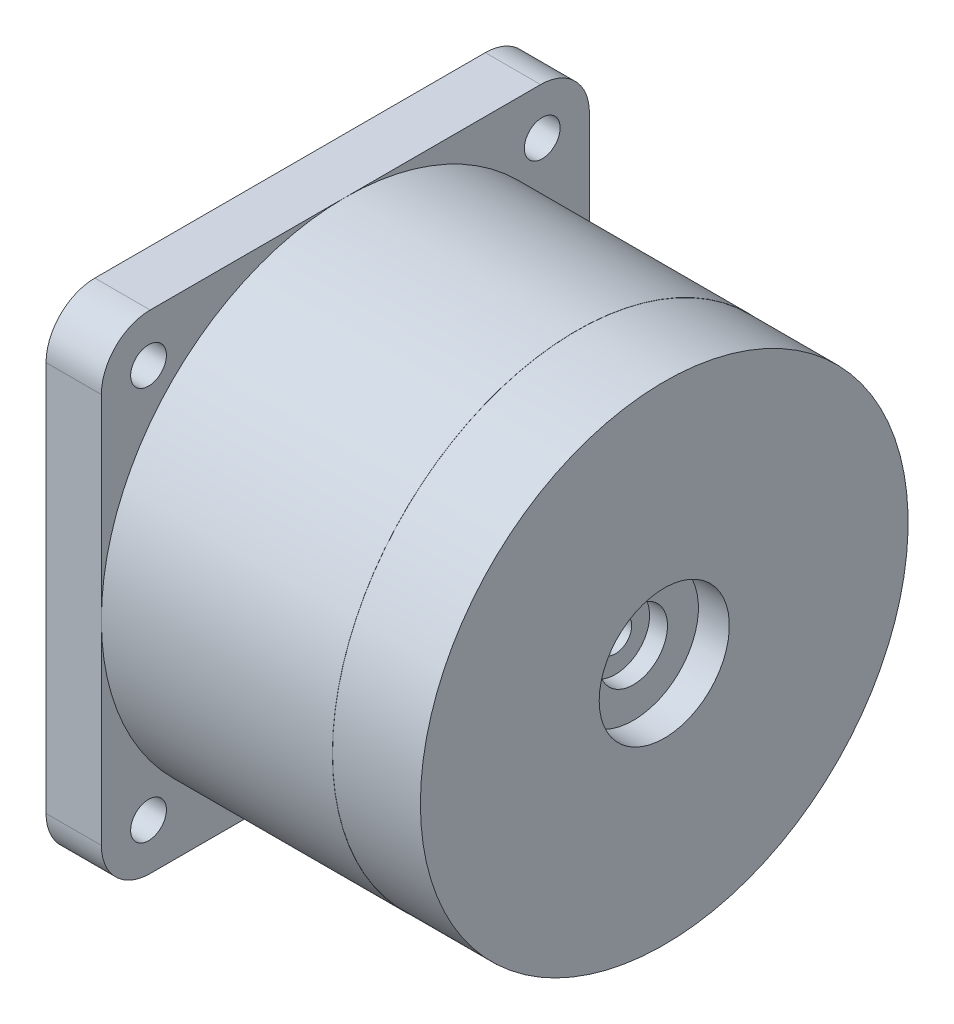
SolidWorks part; units mm, degrees
ref_plane "Plan de face" through (0, 0, 0) normal (0, 0, 1) x (1, 0, 0)
ref_plane "Plan de dessus" through (0, 0, 0) normal (0, 1, 0) x (1, 0, 0)
ref_plane "Plan de droite" through (0, 0, 0) normal (1, 0, 0) x (0, 0, -1)
sketch "Esquisse1" plane through (0, 0, 0) normal (0, 0, 1) x (1, 0, 0)
  line L0 (0, 0) -> (49.68, 0) construction
  line L1 (0, 0) -> (0, 14.99)
  line L2 (0, 14.99) -> (-5.4, 14.99)
  line L3 (-5.4, 14.99) -> (-5.4, 15)
  line L4 (-5.4, 15) -> (-19.6, 15)
  line L5 (-19.6, 15) -> (-19.6, 0)
  line L6 (-19.6, 0) -> (0, 0)
  dimension "D1" = 30
  dimension "D2" = 29.98
  dimension "D3" = 5.4
  dimension "D4" = 19.6
revolve "Révolution1" add sketch "Esquisse1" angle 360 about L0
sketch "Esquisse2" plane through (-19.6, 0, 0) normal (-1, 0, 0) x (0, 0, 1)
  line L0 (-12.1, 12.1) -> (12.1, 12.1) construction
  line L1 (-15, 15) -> (15, 15)
  line L2 (-15, 15) -> (-15, -15)
  line L3 (-15, -15) -> (15, -15)
  line L4 (15, 15) -> (15, -15)
  line L5 (12.1, 12.1) -> (12.1, -12.1) construction
  line L6 (-12.1, -12.1) -> (12.1, -12.1) construction
  line L7 (-12.1, 12.1) -> (-12.1, -12.1) construction
  circle A0 centre (-12.1, 12.1) radius 1.1
  circle A1 centre (12.1, 12.1) radius 1.1
  circle A2 centre (-12.1, -12.1) radius 1.1
  circle A3 centre (12.1, -12.1) radius 1.1
  dimension "D6" = 2.2
  dimension "D2" = 30
  dimension "D3" = 15
  dimension "D4" = 15
  dimension "D1" = 24.2
  dimension "D5" = 30
extrude "Extrusion1" add sketch "Esquisse2" along normal blind 3.4
sketch "Esquisse3" plane through (-23, 0, 0) normal (-1, 0, 0) x (0, 0, 1)
  circle A0 centre (0, 0) radius 13.5
  dimension "D1" = 27
extrude "Enlèv. mat.-Extru.1" cut sketch "Esquisse3" against normal blind 1.6
fillet "Congé1" radius 3 4 edges at (-21.3, 15, 15) (-21.3, -15, 15) (-21.3, -15, -15) (-21.3, 15, -15)
sketch "Esquisse4" plane through (-21.4, 0, 0) normal (-1, 0, 0) x (0, 0, 1)
  line L0 (0, 0) -> (0, -4.9) construction
  circle A0 centre (0, -4.9) radius 5
  dimension "D2" = 10
  dimension "D1" = 4.9
extrude "Extrusion2" add sketch "Esquisse4" along normal blind 7.55
sketch "Esquisse5" plane through (0, 0, 0) normal (0, 0, 1) x (1, 0, 0)
  line L0 (0, 0) -> (0, 4)
  line L1 (0, 4) -> (-1.9, 4)
  line L2 (-1.9, 4) -> (-1.9, 2.1)
  line L3 (-1.9, 2.1) -> (-3, 2.1)
  line L4 (-3, 2.1) -> (-3, 1)
  line L5 (-3, 1) -> (-11.5, 1)
  line L6 (-11.5, 1) -> (-11.5, 0)
  line L7 (-11.5, 0) -> (0, 0)
  line L8 (0, 0) -> (6.4969, 0) construction
  dimension "D1" = 3
  dimension "D2" = 1.1
  dimension "D3" = 8.5
  dimension "D4" = 2
  dimension "D5" = 4.2
  dimension "D6" = 8
revolve "Enlèvement de matière-Révolution1" cut sketch "Esquisse5" angle 360 about L8
sketch "Esquisse6" plane through (-28.95, 0, 0) normal (-1, 0, 0) x (0, 0, 1)
  circle A0 centre (0, -4.9) radius 2.5
  dimension "D1" = 5
extrude "Enlèv. mat.-Extru.2" cut sketch "Esquisse6" against normal blind 15
